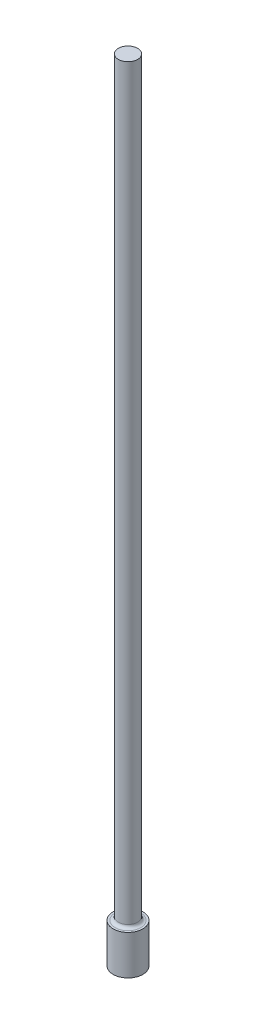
SolidWorks part; units mm, degrees
ref_plane "Front Plane" through (0, 0, 0) normal (0, 0, 1) x (1, 0, 0)
ref_plane "Top Plane" through (0, 0, 0) normal (0, 1, 0) x (1, 0, 0)
ref_plane "Right Plane" through (0, 0, 0) normal (1, 0, 0) x (0, 0, -1)
sketch "Sketch1" plane through (0, 0, 0) normal (0, 0, 1) x (1, 0, 0)
  line L0 (0, 0) -> (0, -1.906) construction
  line L1 (0, 0) -> (1.1938, 0)
  line L2 (1.1938, 0) -> (1.1938, 3.175)
  line L3 (1.1938, 3.175) -> (1.0287, 3.175)
  line L4 (0.7747, 3.429) -> (0.7747, 63.5)
  line L6 (0, 63.5) -> (0.7747, 63.5)
  line L7 (0, 63.5) -> (0, 0)
  arc A0 (1.0287, 3.175) -> (0.7747, 3.429) centre (1.0287, 3.429) cw
  dimension "D5" = 0.254
  dimension "D" = 1.5494
  dimension "H" = 2.3876
  dimension "D4" = 63.5
  dimension "T" = 3.175
revolve "Revolve3" add sketch "Sketch1" angle 360 about L0
